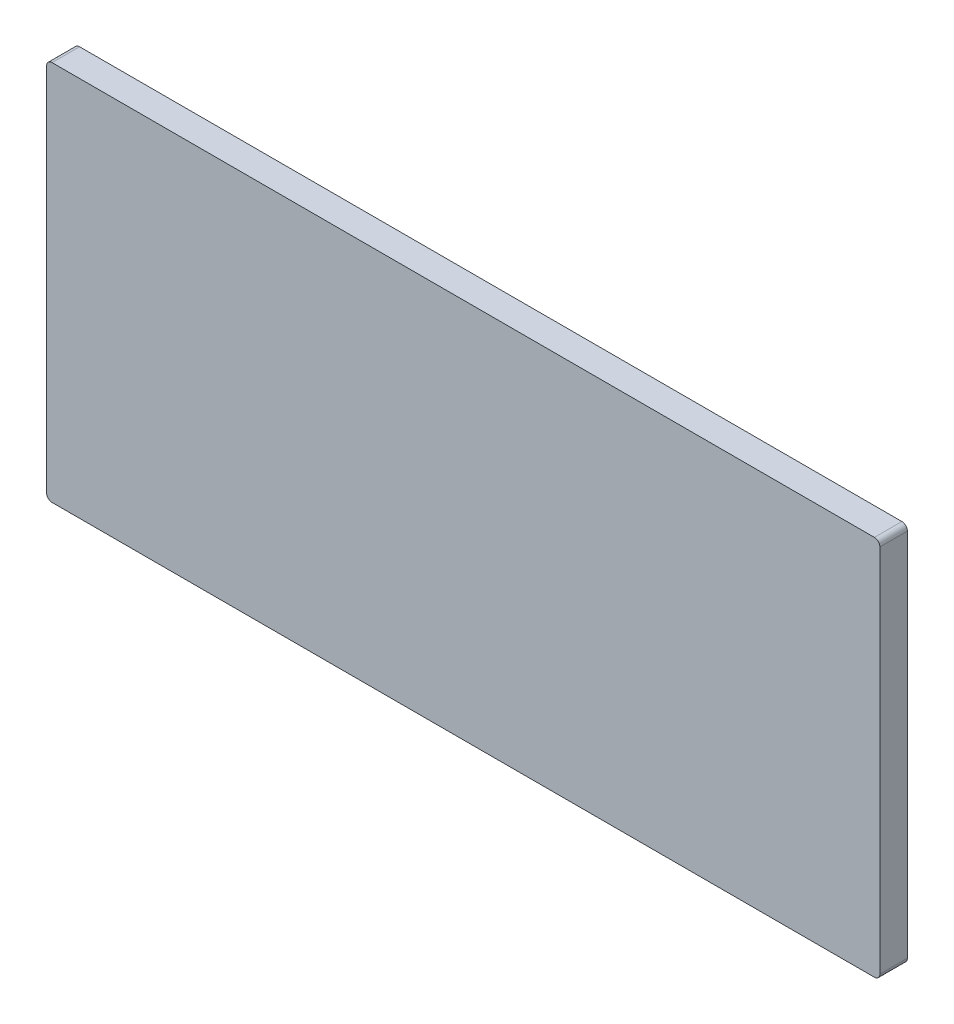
SolidWorks part; units mm, degrees
ref_plane "Plan de face" through (0, 0, 0) normal (0, 0, 1) x (1, 0, 0)
ref_plane "Plan de dessus" through (0, 0, 0) normal (0, 1, 0) x (1, 0, 0)
ref_plane "Plan de droite" through (0, 0, 0) normal (1, 0, 0) x (0, 0, -1)
sketch "Esquisse1" plane through (0, 0, 0) normal (0, 0, 1) x (1, 0, 0)
  line L1 (-62.3927, 97.5778) -> (236.6073, 97.5778)
  line L2 (-64.3927, 95.5778) -> (-64.3927, -38.9222)
  line L3 (-62.3927, -40.9222) -> (236.6073, -40.9222)
  line L4 (238.6073, 95.5778) -> (238.6073, -38.9222)
  arc A0 (-64.3927, -38.9222) -> (-62.3927, -40.9222) centre (-62.3927, -38.9222) ccw
  arc A1 (236.6073, -40.9222) -> (238.6073, -38.9222) centre (236.6073, -38.9222) ccw
  arc A2 (236.6073, 97.5778) -> (238.6073, 95.5778) centre (236.6073, 95.5778) cw
  arc A3 (-62.3927, 97.5778) -> (-64.3927, 95.5778) centre (-62.3927, 95.5778) ccw
  dimension "D3" = 2
  dimension "D1" = 303
  dimension "D2" = 138.5
extrude "Boss.-Extru.1" add sketch "Esquisse1" along normal blind 10
